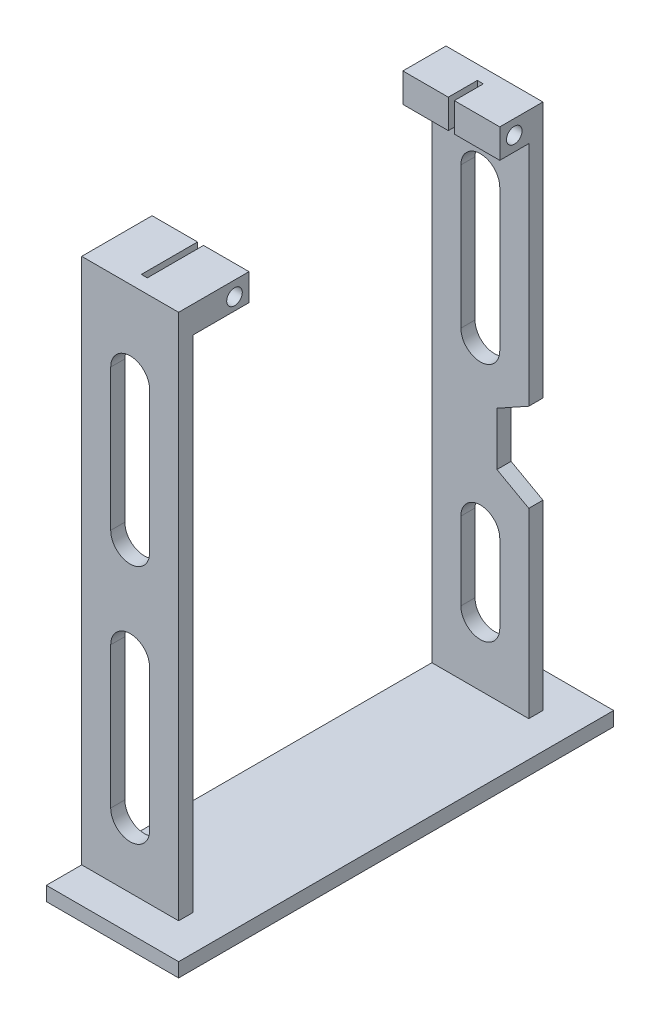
SolidWorks part; units mm, degrees
ref_plane "Front Plane" through (0, 0, 0) normal (0, 0, 1) x (1, 0, 0)
ref_plane "Top Plane" through (0, 0, 0) normal (0, 1, 0) x (1, 0, 0)
ref_plane "Right Plane" through (0, 0, 0) normal (1, 0, 0) x (0, 0, -1)
sketch "Sketch2" plane through (0, 0, 0) normal (0, 1, 0) x (1, 0, 0)
  line L0 (-13.7, 54) -> (-13.7, -49)
  line L1 (-13.7, -49) -> (13.7, -49)
  line L2 (13.7, -49) -> (13.7, 54)
  line L3 (13.7, 54) -> (-13.7, 54)
extrude "Boss-Extrude1" add sketch "Sketch2" along normal blind 2
sketch "Sketch3" plane through (0, 2, 0) normal (0, 1, 0) x (1, 0, 0)
  line L0 (-13.7, -49) -> (-13.7, -45)
  line L1 (-13.7, 54) -> (-13.7, -49) construction
  line L2 (-13.7, -45) -> (13.7, -45)
  line L3 (13.7, -49) -> (13.7, 54) construction
  line L4 (13.7, -45) -> (13.7, -49)
  line L5 (13.7, -49) -> (-13.7, -49)
extrude "Boss-Extrude2" add sketch "Sketch3" along normal blind 149
sketch "Sketch4" plane through (0, 2, 0) normal (0, 1, 0) x (1, 0, 0)
  line L0 (-13.7, 54) -> (-13.7, 50)
  line L1 (-13.7, 54) -> (-13.7, -45) construction
  line L2 (-13.7, 50) -> (13.7, 50)
  line L3 (13.7, -45) -> (13.7, 54) construction
  line L4 (13.7, 50) -> (13.7, 54)
  line L5 (13.7, 54) -> (-13.7, 54)
  dimension "D1" = 4
extrude "Boss-Extrude3" add sketch "Sketch4" along normal blind 149
sketch "Sketch5" plane through (0, 0, 49) normal (0, 0, 1) x (1, 0, 0)
  line L0 (-13.7, 151) -> (-13.7, 143.4)
  line L1 (-13.7, 151) -> (-13.7, 0) construction
  line L2 (-13.7, 143.4) -> (-0.85, 143.4)
  line L3 (-0.85, 143.4) -> (-0.85, 151)
  line L4 (-13.7, 151) -> (13.7, 151) construction
  line L5 (-0.85, 151) -> (-13.7, 151)
  line L16 (13.7, 151) -> (13.7, 143.4)
  line L17 (13.7, 151) -> (13.7, 0) construction
  line L18 (13.7, 143.4) -> (0.85, 143.4)
  line L19 (0.85, 143.4) -> (0.85, 151)
  line L20 (0.85, 151) -> (13.7, 151)
extrude "Boss-Extrude4" add sketch "Sketch5" against normal blind 19.9
sketch "Sketch8" plane through (0, 0, -54) normal (0, 0, -1) x (-1, 0, 0)
  line L0 (-13.7, 151) -> (-13.7, 142.8)
  line L1 (-13.7, 151) -> (-13.7, 0) construction
  line L2 (-13.7, 142.8) -> (-0.85, 142.8)
  line L3 (-0.85, 142.8) -> (-0.85, 151)
  line L4 (-13.7, 151) -> (13.7, 151) construction
  line L5 (-0.85, 151) -> (-13.7, 151)
  line L6 (13.7, 151) -> (13.7, 142.8)
  line L7 (13.7, 151) -> (13.7, 0) construction
  line L8 (13.7, 142.8) -> (0.85, 142.8)
  line L9 (0.85, 142.8) -> (0.85, 151)
  line L10 (0.85, 151) -> (13.7, 151)
extrude "Boss-Extrude5" add sketch "Sketch8" against normal blind 12.2
sketch "Sketch9" plane through (13.7, 0, 0) normal (1, 0, 0) x (0, 0, -1)
  circle A0 centre (45.9, 146.9) radius 2.2
sketch "Sketch10" plane through (13.7, 0, 0) normal (1, 0, 0) x (0, 0, -1)
  circle A0 centre (-33.2, 146.9) radius 2.2
extrude "Cut-Extrude1" cut sketch "Sketch10" against normal blind 30
extrude "Cut-Extrude2" cut sketch "Sketch9" against normal blind 30
sketch "Sketch13" plane through (-13.7, 0, 0) normal (-1, 0, 0) x (0, 0, 1)
  line L0 (-54, 0) -> (49, 0)
  line L1 (49, 0) -> (49, -2)
  line L2 (49, -2) -> (-54, -2)
  line L3 (-54, -2) -> (-54, 0)
extrude "Boss-Extrude6" add sketch "Sketch13" against normal blind 27.4
sketch "Sketch15" plane through (13.7, 0, 0) normal (1, 0, 0) x (0, 0, -1)
  line L0 (-49, -2) -> (-49, 2)
  line L1 (-49, 151) -> (-49, -2) construction
  line L2 (-49, 2) -> (-59, 2)
  line L3 (-59, 2) -> (-59, -2)
  line L4 (-59, -2) -> (-49, -2)
extrude "Boss-Extrude7" add sketch "Sketch15" against normal blind 27.4
sketch "Sketch16" plane through (13.7, 0, 0) normal (1, 0, 0) x (0, 0, -1)
  line L0 (54, -2) -> (54, 2)
  line L1 (54, 151) -> (54, -2) construction
  line L2 (54, 2) -> (64, 2)
  line L3 (64, 2) -> (64, -2)
  line L4 (64, -2) -> (54, -2)
extrude "Boss-Extrude8" add sketch "Sketch16" against normal blind 27.4
sketch "Sketch22" plane through (0, 0, -54) normal (0, 0, -1) x (-1, 0, 0)
  line L0 (-13.7, 53.5) -> (-4.7, 58.5)
  line L1 (-13.7, 151) -> (-13.7, 2) construction
  line L2 (-4.7, 58.5) -> (-4.7, 73.5)
  line L3 (-4.7, 73.5) -> (-13.7, 78.5)
  line L4 (-13.7, 78.5) -> (-13.7, 53.5)
sketch "Sketch26" plane through (0, 2, 0) normal (0, 1, 0) x (1, 0, 0)
  line L0 (13.7, -59) -> (23.7, -59)
  line L1 (13.7, 64) -> (23.7, 64)
  line L2 (23.7, 64) -> (23.7, -59)
  line L3 (13.7, 64) -> (13.7, -59)
extrude "Boss-Extrude9" add sketch "Sketch26" against normal blind 4
extrude "Cut-Extrude5" cut sketch "Sketch22" against normal blind 14
sketch "Sketch24" plane through (0, 0, 49) normal (0, 0, 1) x (1, 0, 0)
  line L0 (0, 20.0134) -> (0, 127.9866) construction
  line L1 (-5.5, 20.0134) -> (-5.5, 127.9866)
  line L2 (5.5, 20.0134) -> (5.5, 127.9866)
  arc A0 (-5.5, 20.0134) -> (5.5, 20.0134) centre (0, 20.0134) ccw
  arc A1 (5.5, 127.9866) -> (-5.5, 127.9866) centre (0, 127.9866) ccw
  point P3 (0, 74)
sketch "Sketch29" plane through (0, 0, 49) normal (0, 0, 1) x (1, 0, 0)
  line L0 (0, 20.0134) -> (0, 59.9866) construction
  line L1 (0, 20.0134) -> (0, 127.9866) construction
  line L2 (-5.5, 20.0134) -> (-5.5, 59.9866)
  line L3 (5.5, 20.0134) -> (5.5, 59.9866)
  line L4 (0, 127.9866) -> (0, 88.0134) construction
  line L5 (5.5, 127.9866) -> (5.5, 88.0134)
  line L6 (-5.5, 127.9866) -> (-5.5, 88.0134)
  arc A0 (-5.5, 20.0134) -> (5.5, 20.0134) centre (0, 20.0134) ccw
  arc A1 (5.5, 59.9866) -> (-5.5, 59.9866) centre (0, 59.9866) ccw
  arc A2 (5.5, 127.9866) -> (-5.5, 127.9866) centre (0, 127.9866) ccw
  arc A3 (-5.5, 88.0134) -> (5.5, 88.0134) centre (0, 88.0134) ccw
  point P5 (0, 40)
  point P10 (0, 108)
  point P18 (0, 0)
extrude "Cut-Extrude8" cut sketch "Sketch29" against normal blind 14
sketch "Sketch25" plane through (0, 0, -54) normal (0, 0, -1) x (-1, 0, 0)
  line L0 (0, 41.9866) -> (0, 20.0134) construction
  line L1 (0, 20.0134) -> (0, 127.9866) construction
  line L2 (5.5, 41.9866) -> (5.5, 20.0134)
  line L3 (-5.5, 41.9866) -> (-5.5, 20.0134)
  line L4 (0, 127.9866) -> (0, 88.0134) construction
  line L5 (5.5, 127.9866) -> (5.5, 88.0134)
  line L6 (-5.5, 127.9866) -> (-5.5, 88.0134)
  arc A0 (5.5, 41.9866) -> (-5.5, 41.9866) centre (0, 41.9866) ccw
  arc A1 (-5.5, 20.0134) -> (5.5, 20.0134) centre (0, 20.0134) ccw
  arc A2 (5.5, 127.9866) -> (-5.5, 127.9866) centre (0, 127.9866) ccw
  arc A3 (-5.5, 88.0134) -> (5.5, 88.0134) centre (0, 88.0134) ccw
  point P5 (0, 31)
  point P12 (0, 108)
  point P17 (0, 85.9351)
  point P18 (0, 0)
  point P19 (0, 0)
  point P20 (0, 0)
  point P21 (0, 42.6449)
  point P23 (0, 42.4407)
  point P24 (0, 0)
extrude "Cut-Extrude7" cut sketch "Sketch25" against normal blind 14
